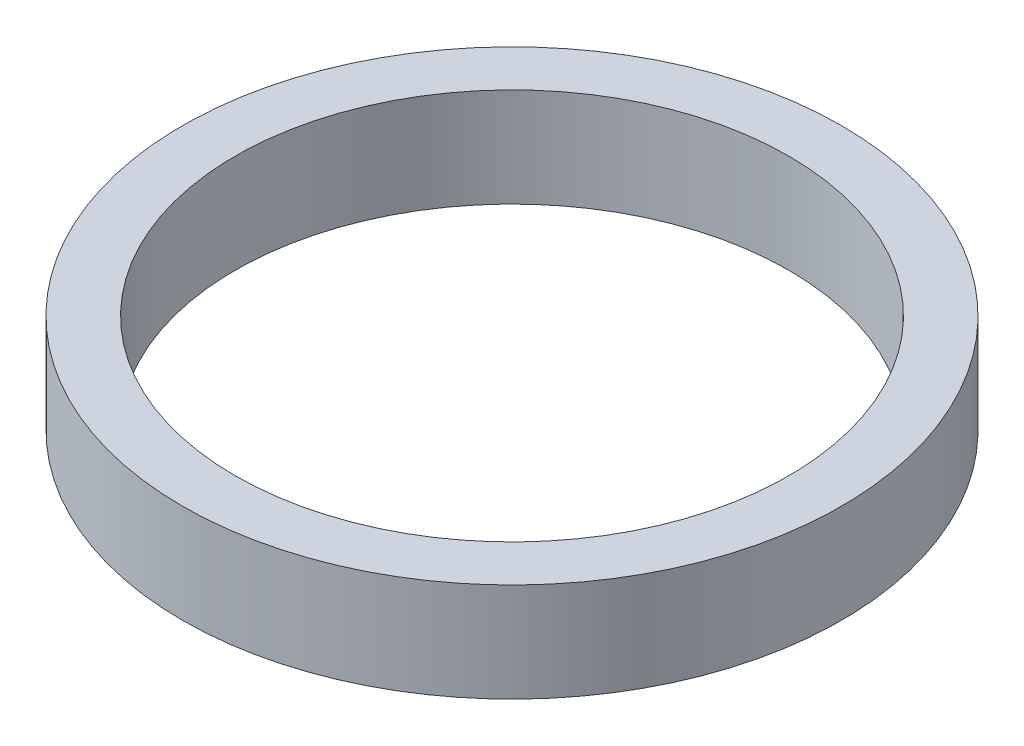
SolidWorks part; units mm, degrees
ref_plane "Plan1" through (0, 0, 0) normal (0, 0, 1) x (1, 0, 0)
ref_plane "Plan2" through (0, 0, 0) normal (0, 1, 0) x (1, 0, 0)
ref_plane "Plan3" through (0, 0, 0) normal (1, 0, 0) x (0, 0, -1)
sketch "Esquisse1" plane through (0, 0, 0) normal (0, 0, 1) x (1, 0, 0)
  line L1 (0, 0) -> (0, 2.5443) construction
  line L2 (4.2, 0) -> (4.2, 1.5)
  line L3 (4.2, 0) -> (5, 0)
  line L4 (5, 0) -> (5, 1.5)
  line L5 (5, 1.5) -> (4.2, 1.5)
  line L6 (4.2, 0) -> (-4.2, 0) construction
  line L7 (5, 0) -> (-5, 0) construction
  dimension "Rint" = 4.2
  dimension "Rext" = 5
  dimension "Epaisseur" = 1.5
  dimension "Diamètre de passage" = 8.4
  dimension "Diamètre extérieur" = 10
revolve "Base-Révolution" add sketch "Esquisse1" angle 360 about L1
equation "\"Rext@Esquisse1\"=\"Diamètre extérieur@Esquisse1\"/2"
equation "\"Rint@Esquisse1\" = \"Diamètre de passage@Esquisse1\"/2"
